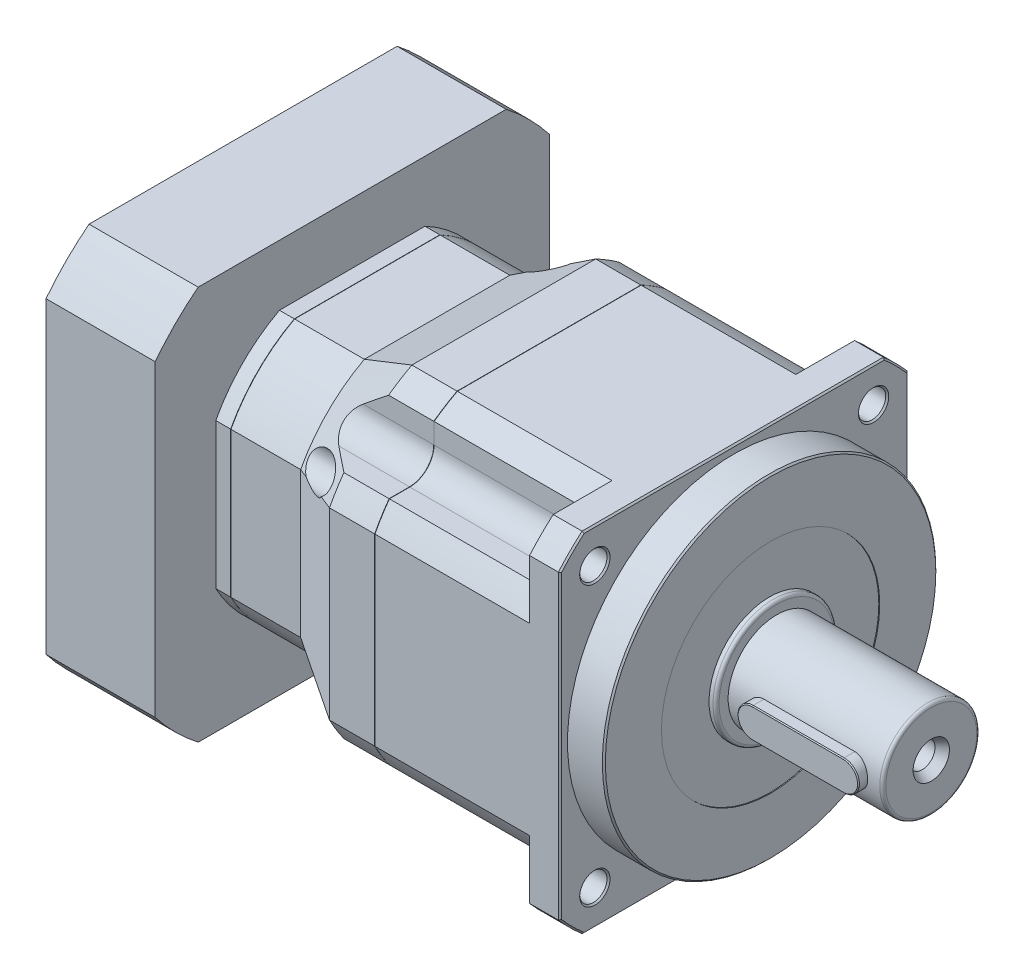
SolidWorks part; units mm, degrees
other "TeethCuts"
ref_plane "前视基准面" through (0, 0, 0) normal (0, 0, 1) x (1, 0, 0)
ref_plane "上视基准面" through (0, 0, 0) normal (0, 1, 0) x (1, 0, 0)
ref_plane "右视基准面" through (0, 0, 0) normal (1, 0, 0) x (0, 0, -1)
imported_body "输入1"
sketch "草图1" plane through (-16, 0, 0) normal (-1, 0, 0) x (0, 0, 1)
  circle A0 centre (0, 0) radius 53.7543
extrude "凸台-拉伸1" add sketch "草图1" against normal up to surface (61 mm away)
other "删除面1"
ref_plane "基准面1" through (-16.1, 0, 0) normal (-1, 0, 0) x (0, 0, 1)
sketch "草图3" plane through (-16.1, 0, 0) normal (-1, 0, 0) x (0, 0, 1)
  line L1 (-30.3109, 57.5) -> (30.3109, 57.5)
  line L2 (-57.5, 30.3109) -> (-57.5, -30.3109)
  line L3 (-30.3109, -57.5) -> (30.3109, -57.5)
  line L4 (57.5, 30.3109) -> (57.5, -30.3109)
  arc A0 (-30.3109, 57.5) -> (-57.5, 30.3109) centre (0, 0) ccw
  arc A1 (-57.5, -30.3109) -> (-30.3109, -57.5) centre (0, 0) ccw
  arc A2 (30.3109, -57.5) -> (57.5, -30.3109) centre (0, 0) ccw
  arc A3 (57.5, 30.3109) -> (30.3109, 57.5) centre (0, 0) ccw
  dimension "D1" = 57.5
  dimension "D3" = 57.5
extrude "凸台-拉伸2" add sketch "草图3" along normal blind 14.9 separate body
ref_plane "基准面4" through (-53, 0, 0) normal (-1, 0, 0) x (0, 0, 1)
sketch "草图22" plane through (-53, 0, 0) normal (-1, 0, 0) x (0, 0, 1)
  line L1 (-24, 45) -> (24, 45)
  line L2 (-45, 24) -> (-45, -24)
  line L3 (-24, -45) -> (24, -45)
  line L4 (45, 24) -> (45, -24)
  arc A0 (-24, 45) -> (-45, 24) centre (0, 0) ccw
  arc A1 (-45, -24) -> (-24, -45) centre (0, 0) ccw
  arc A2 (24, -45) -> (45, -24) centre (0, 0) ccw
  arc A3 (45, 24) -> (24, 45) centre (0, 0) ccw
  dimension "D1" = 45
  dimension "D3" = 45
extrude "凸台-拉伸11" add sketch "草图22" along normal blind 23 separate body
loft "放样1" add
sketch "草图4" plane through (-16.1, 0, 0) normal (1, 0, 0) x (0, 0, -1)
  line L0 (38, 46) -> (38, 52.7352) construction
  line L1 (52.7352, 38) -> (46, 38) construction
  line L2 (38, 46) -> (38, 52.7352)
  line L3 (52.7352, 38) -> (46, 38)
  arc A0 (38, 46) -> (46, 38) centre (46, 46) ccw construction
  arc A1 (38, 46) -> (46, 38) centre (46, 46) ccw
  arc A2 (52.7352, 38) -> (38, 52.7352) centre (0, 0) ccw
extrude "切除-拉伸1" cut sketch "草图4" against normal blind 60
pattern_circular "阵列(圆周)1" count 4 over 360 about axis through (0, 0, 0) along (1, 0, 0) of "切除-拉伸1"
ref_plane "基准面2" through (-76.1, 0, 0) normal (-1, 0, 0) x (0, 0, 1)
sketch "草图23" plane through (-76.1, 0, 0) normal (-1, 0, 0) x (0, 0, 1)
  line L1 (-24, 45) -> (24, 45)
  line L2 (-45, 24) -> (-45, -24)
  line L3 (-24, -45) -> (24, -45)
  line L4 (45, 24) -> (45, -24)
  arc A1 (-24, 45) -> (-45, 24) centre (0, 0) ccw
  arc A2 (-45, -24) -> (-24, -45) centre (0, 0) ccw
  arc A3 (24, -45) -> (45, -24) centre (0, 0) ccw
  arc A4 (45, 24) -> (24, 45) centre (0, 0) ccw
  dimension "D1" = 45
  dimension "D2" = 45
  dimension "D3" = 45
extrude "凸台-拉伸12" add sketch "草图23" along normal blind 4.9 separate body
sketch "草图24" plane through (-81, 0, 0) normal (-1, 0, 0) x (0, 0, 1)
  line L1 (-50.806, 65) -> (50.806, 65)
  line L2 (-65, 50.806) -> (-65, -50.806)
  line L3 (-50.806, -65) -> (50.806, -65)
  line L4 (65, 50.806) -> (65, -50.806)
  arc A0 (65, 50.806) -> (50.806, 65) centre (0, 0) ccw
  arc A1 (-50.806, 65) -> (-65, 50.806) centre (0, 0) ccw
  arc A2 (-65, -50.806) -> (-50.806, -65) centre (0, 0) ccw
  arc A3 (50.806, -65) -> (65, -50.806) centre (0, 0) ccw
  dimension "D1" = 65
  dimension "D3" = 65
extrude "凸台-拉伸13" add sketch "草图24" along normal blind 36
sketch "草图25" plane through (-117, 0, 0) normal (-1, 0, 0) x (0, 0, 1)
  circle A0 centre (0, 0) radius 55
extrude "切除-拉伸2" cut sketch "草图25" against normal blind 8
sketch "草图26" plane through (-109, 0, 0) normal (-1, 0, 0) x (0, 0, 1)
  circle A0 centre (0, 0) radius 54
extrude "切除-拉伸3" cut sketch "草图26" against normal blind 13
sketch "草图27" plane through (-96, 0, 0) normal (-1, 0, 0) x (0, 0, 1)
  circle A0 centre (0, 0) radius 28
extrude "切除-拉伸4" cut sketch "草图27" against normal blind 14
sketch "草图28" plane through (-96, 0, 0) normal (-1, 0, 0) x (0, 0, 1)
  line L0 (0, 0) -> (0, -40) construction
  line L1 (0, 0) -> (20, -34.641) construction
  circle A0 centre (0, 0) radius 40 construction
  circle A1 centre (20, -34.641) radius 5.5
  dimension "D1" = 30
extrude "切除-拉伸5" cut sketch "草图28" against normal blind 12
pattern_circular "阵列(圆周)2" count 4 over 360 about axis through (0, 0, 0) along (1, 0, 0) of "切除-拉伸5"
sketch "草图29" plane through (-96, 0, 0) normal (-1, 0, 0) x (0, 0, 1)
  line L0 (0, 0) -> (0, -40) construction
  line L1 (0, 0) -> (-20, -34.641) construction
  circle A0 centre (0, 0) radius 40 construction
  circle A1 centre (-20, -34.641) radius 5.5
  dimension "D1" = 30
extrude "切除-拉伸6" cut sketch "草图29" against normal blind 12
pattern_circular "阵列(圆周)3" count 2 over 360 about axis through (0, 0, 0) along (1, 0, 0) of "切除-拉伸6"
sketch "草图30" plane through (-117, 0, 0) normal (-1, 0, 0) x (0, 0, 1)
  line L0 (0, 0) -> (-51.2652, 51.2652) construction
  circle A0 centre (0, 0) radius 72.5 construction
hole_wizard "M8 螺纹孔1" positions "3D草图1" profile "草图31" tap size "M8" standard "GB"
sketch3d "3D草图1"
  point P0 (-117, 51.2652, -51.2652)
sketch "草图31" plane through (-117, 51.2652, -51.2652) normal (0, 1, 0) x (0, 0, 1)
  line L0 (0, 0) -> (0, 33.2929)
  line L1 (0, 33.2929) -> (3.4, 31.25)
  line L2 (3.4, 31.25) -> (3.4, 0)
  line L5 (3.4, 0) -> (0, 0)
  line L10 (0, 33.2929) -> (-3.4, 31.25) construction
  line L11 (0, -6.35) -> (0, 107.95) construction
  dimension "螺纹孔钻头直径" = 6.8
  dimension "螺纹孔钻头深度" = 31.25
  dimension "导头角度" = 118
pattern_circular "阵列(圆周)6" count 4 over 360 about axis through (0, 0, 0) along (1, 0, 0) of "M8 螺纹孔1"
sketch "草图32" plane through (-84, 0, 0) normal (-1, 0, 0) x (0, 0, 1)
  line L1 (-18.8118, 37.0942) -> (-21.5304, 36.8967)
  line L2 (-21.5304, 36.8967) -> (-22.7187, 34.4434)
  line L3 (-22.7187, 34.4434) -> (-21.1882, 32.1878)
  line L4 (-21.1882, 32.1878) -> (-18.4696, 32.3854)
  line L5 (-18.4696, 32.3854) -> (-17.2813, 34.8386)
  line L6 (-17.2813, 34.8386) -> (-18.8118, 37.0942)
  circle A0 centre (-20, 34.641) radius 5
  circle A1 centre (-20, 34.641) radius 2.3606 construction
extrude "凸台-拉伸14" add sketch "草图32" along normal blind 6
pattern_circular "阵列(圆周)7" count 4 over 360 about axis through (0, 0, 0) along (1, 0, 0) of "凸台-拉伸14"
sketch "草图33" plane through (-84, 0, 0) normal (-1, 0, 0) x (0, 0, 1)
  line L1 (-18.7809, -32.3853) -> (-21.3439, -32.4574)
  line L2 (-21.3439, -32.4574) -> (-22.563, -34.713)
  line L3 (-22.563, -34.713) -> (-21.2191, -36.8967)
  line L4 (-21.2191, -36.8967) -> (-18.6561, -36.8247)
  line L5 (-18.6561, -36.8247) -> (-17.437, -34.569)
  line L6 (-17.437, -34.569) -> (-18.7809, -32.3853)
  circle A0 centre (-20, -34.641) radius 5
  circle A1 centre (-20, -34.641) radius 2.2205 construction
extrude "凸台-拉伸15" add sketch "草图33" along normal blind 6
pattern_circular "阵列(圆周)8" count 2 over 360 about axis through (0, 0, 0) along (1, 0, 0) of "凸台-拉伸15"
chamfer "倒角1" distance 1 angle 45 1 edges at (-96, 0, 28)
chamfer "倒角2" distance 1 angle 45 1 edges at (-117, 0, 55)
sketch "草图34" plane through (45, 0, 0) normal (1, 0, 0) x (0, 0, -1)
  circle A0 centre (0, 0) radius 49.6364
extrude "凸台-拉伸16" add sketch "草图34" along normal up to surface (12 mm away)
sketch "草图35" plane through (57, 0, 0) normal (1, 0, 0) x (0, 0, -1)
  circle A0 centre (0, 0) radius 20
extrude "凸台-拉伸17" add sketch "草图35" along normal blind 2
fillet "圆角1" radius 1 1 edges at (59, 0, -20)
sketch "草图36" plane through (57, 0, 0) normal (1, 0, 0) x (0, 0, -1)
  circle A0 centre (0, 0) radius 20
  circle A1 centre (0, 0) radius 36
extrude "切除-拉伸7" cut sketch "草图36" against normal blind 0.3
sketch "草图37" plane through (59, 0, 0) normal (1, 0, 0) x (0, 0, -1)
  circle A0 centre (0, 0) radius 16
extrude "凸台-拉伸18" add sketch "草图37" along normal blind 51
fillet "圆角2" radius 1 1 edges at (110, 0, -16)
sketch "草图38" plane through (0, 0, 0) normal (0, 0, 1) x (1, 0, 0)
  line L0 (110, -15) -> (110, 15) construction
  line L1 (100, 5) -> (70, 5)
  line L2 (70, -5) -> (100, -5)
  arc A0 (100, -5) -> (100, 5) centre (100, 0) ccw
  arc A1 (70, 5) -> (70, -5) centre (70, 0) ccw
  dimension "D1" = 10
  dimension "D2" = 30
extrude "凸台-拉伸19" add sketch "草图38" along normal blind 19
chamfer "倒角3" distance 0.3 angle 45 4 edges at (65, 0, 19) (85, -5, 19) (85, 5, 19) (105, 0, 19)
ref_plane "基准面5" through (-25, 0, 0) normal (1, 0, 0) x (0, 0, -1)
sketch "草图39" plane through (-25, 0, 0) normal (1, 0, 0) x (0, 0, -1)
  line L0 (0, 0) -> (0, 57.5) construction
  line L1 (0, 0) -> (30.4704, 48.7628) construction
  circle A0 centre (0, 0) radius 57.5 construction
  circle A1 centre (30.4704, 48.7628) radius 5.5
  dimension "D1" = 32
  dimension "D2" = 115
extrude "切除-拉伸8" cut sketch "草图39" against normal blind 30
pattern_circular "阵列(圆周)9" count 4 over 360 about axis through (0, 0, 0) along (1, 0, 0) of "切除-拉伸8"
sketch "草图40" plane through (-25, 0, 0) normal (-1, 0, 0) x (0, 0, 1)
  line L1 (-31.5316, 51.4503) -> (-33.3284, 49.1875)
  line L2 (-33.3284, 49.1875) -> (-32.2672, 46.4999)
  line L3 (-32.2672, 46.4999) -> (-29.4091, 46.0752)
  line L4 (-29.4091, 46.0752) -> (-27.6123, 48.3381)
  line L5 (-27.6123, 48.3381) -> (-28.6735, 51.0256)
  line L6 (-28.6735, 51.0256) -> (-31.5316, 51.4503)
  circle A0 centre (-30.4704, 48.7628) radius 5
  circle A1 centre (-30.4704, 48.7628) radius 2.5023 construction
extrude "凸台-拉伸20" add sketch "草图40" along normal blind 7
pattern_circular "阵列(圆周)10" count 4 over 360 about axis through (0, 0, 0) along (1, 0, 0) of "凸台-拉伸20"
sketch "草图41" plane through (110, 0, 0) normal (1, 0, 0) x (0, 0, -1)
  circle A0 centre (0, 0) radius 4.25
extrude "切除-拉伸9" cut sketch "草图41" against normal blind 8
sketch "草图42" plane through (110, 0, 0) normal (1, 0, 0) x (0, 0, -1)
  circle A0 centre (0, 0) radius 6
ref_plane "基准面6" through (107, 0, 0) normal (1, 0, 0) x (0, 0, -1)
sketch "草图43" plane through (107, 0, 0) normal (1, 0, 0) x (0, 0, -1)
  circle A0 centre (0, 0) radius 4.25 construction
  circle A1 centre (0, 0) radius 4.25
loft "切除-放样1" cut profiles "草图43", "草图42"
hole_wizard "M8 螺纹孔2" positions "3D草图2" profile "草图44" tap size "M8" standard "GB"
sketch3d "3D草图2"
  line L0 (102, 0, 0) -> (107, 0, 0) construction
  point P0 (102, 0, 0)
sketch "草图44" plane through (102, 0, 0) normal (0, 1, 0) x (0, 0, -1)
  line L0 (0, 0) -> (0, 25.2929)
  line L1 (0, 25.2929) -> (3.4, 23.25)
  line L2 (3.4, 23.25) -> (3.4, 0)
  line L5 (3.4, 0) -> (0, 0)
  line L10 (0, 25.2929) -> (-3.4, 23.25) construction
  line L11 (0, -6.35) -> (0, 107.95) construction
  dimension "螺纹孔钻头直径" = 6.8
  dimension "螺纹孔钻头深度" = 23.25
  dimension "导头角度" = 118
ref_plane "基准面7" through (-94, 0, 0) normal (-1, 0, 0) x (0, 0, 1)
sketch "草图45" plane through (-94, 0, 0) normal (-1, 0, 0) x (0, 0, 1)
  circle A0 centre (0, 0) radius 25
extrude "凸台-拉伸21" add sketch "草图45" against normal up to surface (12 mm away)
chamfer "倒角4" distance 1 angle 45 1 edges at (-94, 0, 25)
sketch "草图46" plane through (-117, 0, 0) normal (-1, 0, 0) x (0, 0, 1)
  circle A0 centre (0, 0) radius 12
extrude "切除-拉伸10" cut sketch "草图46" against normal blind 60
sketch "草图47" plane through (-94, 0, 0) normal (-1, 0, 0) x (0, 0, 1)
  line L1 (-26.0665, 0.5) -> (26.4504, 0.5)
  line L2 (-26.0665, 0.5) -> (-26.0665, -0.5)
  line L3 (-26.0665, -0.5) -> (26.4504, -0.5)
  line L4 (26.4504, 0.5) -> (26.4504, -0.5)
  dimension "D1" = 0.5
  dimension "D2" = 1
extrude "切除-拉伸11" cut sketch "草图47" against normal up to surface (12 mm away)
